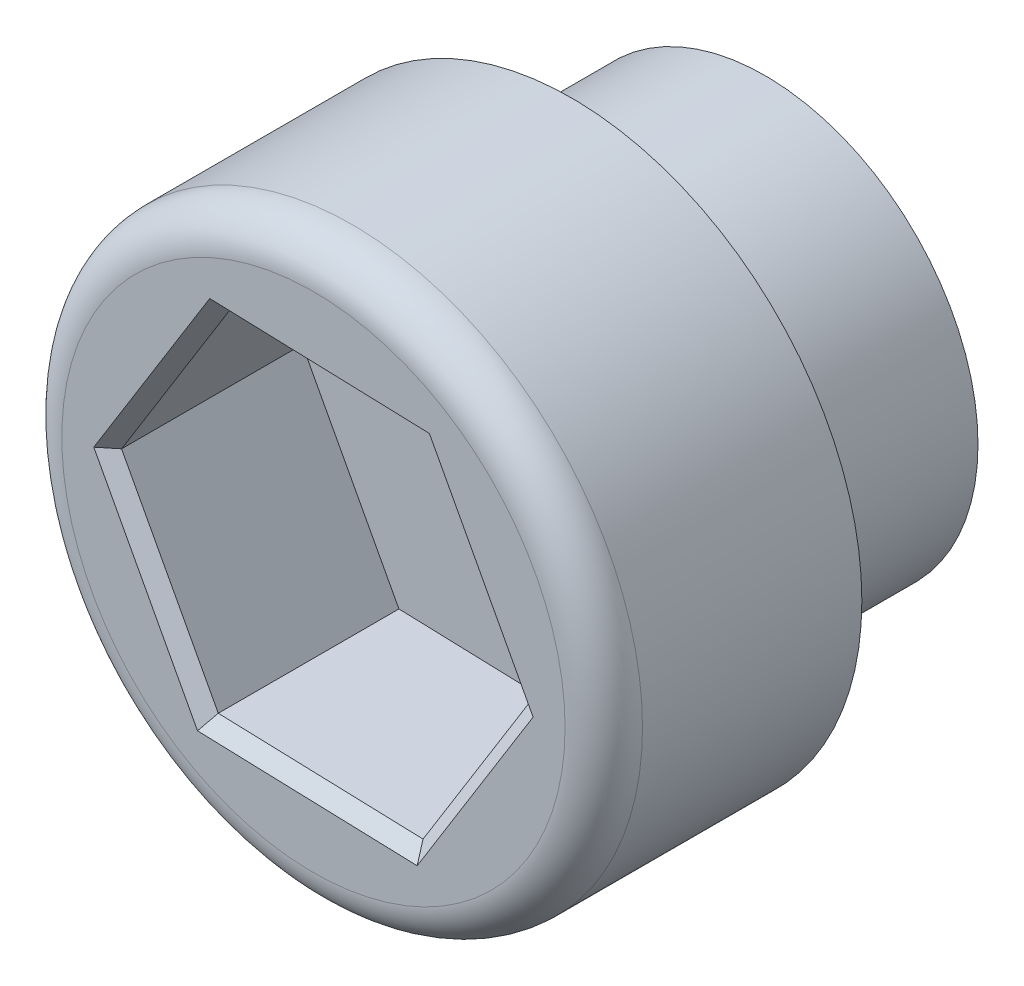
SolidWorks part; units mm, degrees
ref_plane "Płaszczyzna przednia" through (0, 0, 0) normal (0, 0, 1) x (1, 0, 0)
ref_plane "Płaszczyzna górna" through (0, 0, 0) normal (0, 1, 0) x (1, 0, 0)
ref_plane "Płaszczyzna prawa" through (0, 0, 0) normal (1, 0, 0) x (0, 0, -1)
sketch "Szkic1" plane through (0, 0, 0) normal (0, 0, 1) x (1, 0, 0)
  circle A0 centre (0, 0) radius 3.3
  dimension "D1" = 6.6
extrude "Dodanie-wyciągnięcie1" add sketch "Szkic1" along normal blind 3
sketch "Szkic2" plane through (0, 0, 3) normal (0, 0, 1) x (1, 0, 0)
  circle A0 centre (0, 0) radius 4.5
  dimension "D1" = 9
extrude "Dodanie-wyciągnięcie2" add sketch "Szkic2" along normal blind 4
sketch "Szkic3" plane through (0, 0, 7) normal (0, 0, 1) x (1, 0, 0)
  line L1 (-1.4986, 2.7995) -> (-3.1738, 0.1019)
  line L2 (-3.1738, 0.1019) -> (-1.6752, -2.6976)
  line L3 (-1.6752, -2.6976) -> (1.4986, -2.7995)
  line L4 (1.4986, -2.7995) -> (3.1738, -0.1019)
  line L5 (3.1738, -0.1019) -> (1.6752, 2.6976)
  line L6 (1.6752, 2.6976) -> (-1.4986, 2.7995)
  circle A0 centre (0, 0) radius 2.75 construction
  dimension "D1" = 5.5
extrude "Wytnij-wyciągnięcie1" cut sketch "Szkic3" against normal blind 3
fillet "Zaokrąglenie1" radius 0.6 1 edges at (4.5, 0, 7)
chamfer "Sfazowanie1" distance 0.2 angle 45 6 edges at (-0.0883, -2.7486, 7) (-2.4245, -1.2979, 7) (-2.3362, 1.4507, 7) (0.0883, 2.7486, 7) (2.4245, 1.2979, 7) (2.3362, -1.4507, 7)
